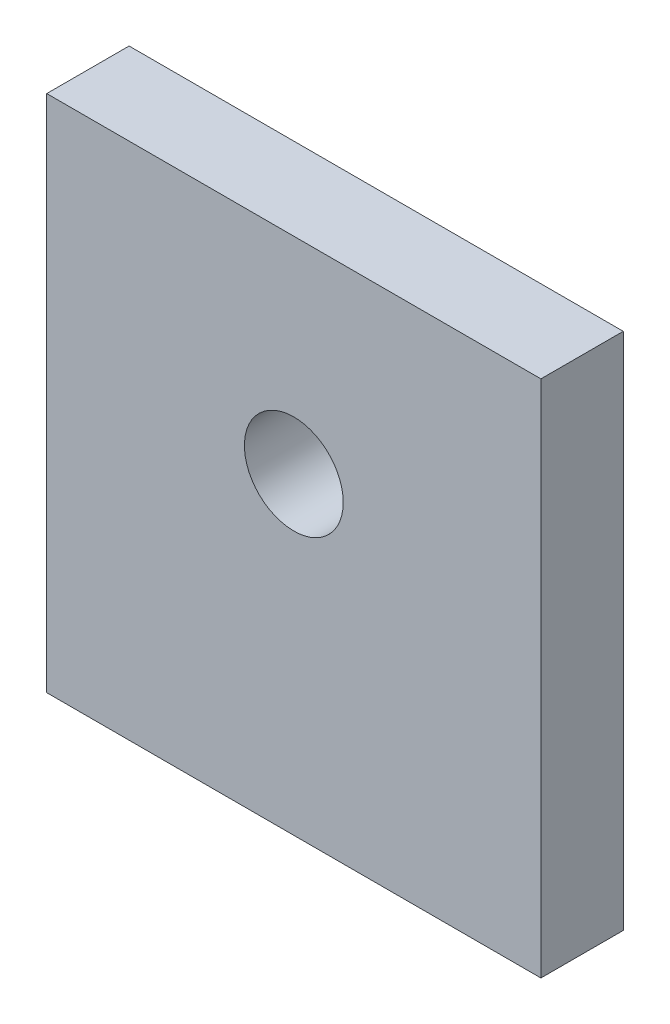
SolidWorks part; units mm, degrees
ref_plane "Front Plane" through (0, 0, 0) normal (0, 0, 1) x (1, 0, 0)
ref_plane "Top Plane" through (0, 0, 0) normal (0, 1, 0) x (1, 0, 0)
ref_plane "Right Plane" through (0, 0, 0) normal (1, 0, 0) x (0, 0, -1)
sketch "Sketch1" plane through (0, 0, 0) normal (0, 0, 1) x (1, 0, 0)
  line L0 (0, 6.5) -> (0, 31.5) construction
  line L1 (-30, -31.5) -> (30, -31.5)
  line L2 (-30, -31.5) -> (-30, 31.5)
  line L3 (-30, 31.5) -> (30, 31.5)
  line L4 (30, -31.5) -> (30, 31.5)
  line L5 (-30, -31.5) -> (30, 31.5) construction
  line L6 (-30, 31.5) -> (30, -31.5) construction
  circle A0 centre (0, 6.5) radius 6
  point P0 (0, 0)
  dimension "D3" = 12
  dimension "D1" = 63
  dimension "D2" = 60
  dimension "D4" = 25
extrude "Boss-Extrude1" add sketch "Sketch1" along normal blind 10
